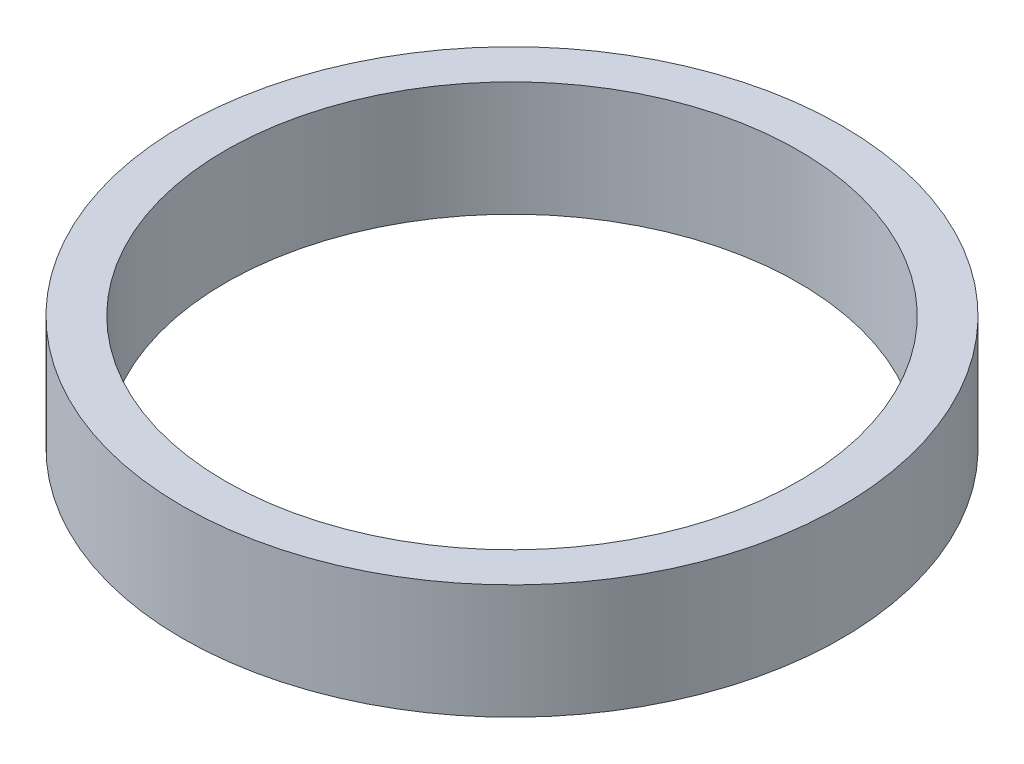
SolidWorks part; units mm, degrees
ref_plane "Front Plane" through (0, 0, 0) normal (0, 0, 1) x (1, 0, 0)
ref_plane "Top Plane" through (0, 0, 0) normal (0, 1, 0) x (1, 0, 0)
ref_plane "Right Plane" through (0, 0, 0) normal (1, 0, 0) x (0, 0, -1)
sketch "Sketch1" plane through (0, 0, 0) normal (0, 1, 0) x (1, 0, 0)
  circle A0 centre (0, 0) radius 10
  circle A1 centre (0, 0) radius 11.5
extrude "Boss-Extrude1" add sketch "Sketch1" along normal blind 4
